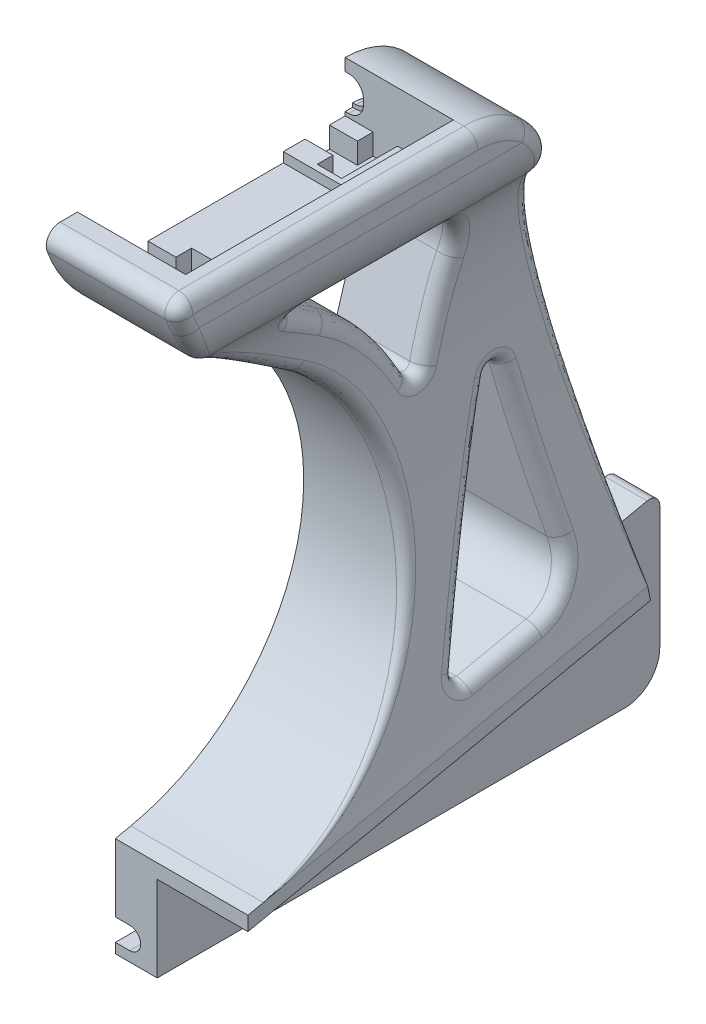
SolidWorks part; units mm, degrees
ref_plane "Front Plane" through (0, 0, 0) normal (0, 0, 1) x (1, 0, 0)
ref_plane "Top Plane" through (0, 0, 0) normal (0, 1, 0) x (1, 0, 0)
ref_plane "Right Plane" through (0, 0, 0) normal (1, 0, 0) x (0, 0, -1)
body saved out of another part "Stock-charging stand-1"
sketch "Sketch1" plane through (0, 0, 0) normal (-1, 0, 0) x (0, 0, 1)
  line L1 (73.1491, 82.0055) -> (57.4196, 70.9915) construction
  line L4 (71.0701, 0) -> (4.0701, 0) construction
  line L6 (26.2756, 85.1389) -> (12.7642, 21.573) construction
  line L7 (69.4336, 94.75) -> (38.1442, 94.75)
  line L8 (73.1491, 82.0055) -> (57.4196, 70.9915)
  line L9 (71.0701, 14.2914) -> (71.0701, 4.575) construction
  line L10 (12.7642, 21.573) -> (7.4455, 22.7035) construction
  line L11 (60.2722, 0) -> (9.02, 0)
  line L12 (-0.9299, 22.6314) -> (-0.9299, 5) construction
  line L13 (26.2756, 85.1389) -> (12.7642, 21.573)
  line L14 (8.8026, 22.4151) -> (12.7642, 21.573)
  line L15 (-1.9299, 14.6858) -> (-1.9299, 9.798)
  line L16 (79.0701, 13.2914) -> (79.0701, 1)
  line L17 (-0.9299, 5) -> (-0.9299, 22.6314) construction
  line L18 (12.7642, 21.573) -> (0.882, 24.0986) construction
  arc A0 (38.1442, 94.75) -> (26.2756, 85.1389) centre (38.1442, 82.6162) ccw construction
  arc A2 (73.1491, 82.0055) -> (80.8539, 92.0702) centre (61.104, 99.2077) ccw construction
  arc A3 (57.4196, 70.9915) -> (68.8598, 14.7612) centre (75.3645, 45.3636) ccw construction
  arc A6 (38.1442, 94.75) -> (26.2756, 85.1389) centre (38.1442, 82.6162) ccw
  arc A7 (80.8539, 92.0702) -> (78.9729, 94.75) centre (78.9729, 92.75) ccw construction
  arc A8 (73.1491, 82.0055) -> (75.4657, 83.8864) centre (61.104, 99.2077) ccw
  arc A9 (57.4196, 70.9915) -> (61.0389, 17.55) centre (75.3645, 45.3636) ccw
  arc A11 (69.4336, 94.75) -> (70.3875, 95.45) centre (69.4336, 95.75) ccw
  arc A12 (76.432, 84.1161) -> (70.3875, 95.45) centre (78.9729, 92.75) ccw
  arc A13 (61.252, -0.8) -> (79.0701, 1) centre (70.0701, 1) ccw
  arc A14 (79.0701, 13.2914) -> (62.3542, 17.9243) centre (70.0701, 13.2914) ccw
  arc A15 (8.0165, 23.5023) -> (-2.7299, 15.6656) centre (-0.9299, 24.4838) ccw
  arc A16 (-2.7299, 8.8182) -> (8.025, -0.9) centre (-0.9299, 0) ccw
  arc A17 (76.432, 84.1161) -> (75.4657, 83.8864) centre (76.1496, 83.1568) ccw
  arc A18 (61.0389, 17.55) -> (62.3542, 17.9243) centre (61.4968, 18.439) ccw
  arc A19 (60.2722, 0) -> (61.252, -0.8) centre (60.2722, -1) cw
  arc A20 (8.025, -0.9) -> (9.02, 0) centre (9.02, -1) cw
  arc A21 (-1.9299, 9.798) -> (-2.7299, 8.8182) centre (-2.9299, 9.798) cw
  arc A22 (-1.9299, 14.6858) -> (-2.7299, 15.6656) centre (-2.9299, 14.6858) ccw
  arc A23 (8.0165, 23.5023) -> (8.8026, 22.4151) centre (9.0105, 23.3932) ccw
  dimension "D1" = 18
  dimension "D8" = 1
  dimension "D2" = 1
  dimension "D3" = 1
  dimension "D4" = 1
  dimension "D6" = 1
extrude "Boss-Extrude1" [suppressed] add sketch "Sketch1" along normal blind 0.35 contours A15 A22 L15 A21 A16 A20 L11 A19 A13 L16 A14 A18 A9 L8 A8 A17 A12 A11 L7 A6 L13 L14 A23
sketch "Sketch3" [suppressed] plane through (0, 0, 0) normal (1, 0, 0) x (0, 0, -1)
  line L0 (-0.5701, 22.6314) -> (-0.5701, 31.6314) construction
  line L1 (-0.5701, 22.6314) -> (8.4299, 22.6314) construction
  line L2 (-0.5701, 22.6314) -> (5.7938, 28.9954) construction
  line L3 (-0.0701, 22.6314) -> (-0.0701, 31.6314)
  line L4 (-0.2166, 22.2779) -> (6.1474, 28.6418)
  line L5 (-0.5701, 22.1314) -> (8.4299, 22.1314)
  line L6 (-1.0701, 22.6314) -> (-1.0701, 31.6314)
  line L7 (-0.9237, 22.985) -> (5.4403, 29.3489)
  line L8 (-0.5701, 23.1314) -> (8.4299, 23.1314)
  line L9 (-0.0701, 22.6314) -> (-1.0701, 22.6314)
  line L10 (-0.0701, 31.6314) -> (-1.0701, 31.6314)
  line L11 (-0.2166, 22.2779) -> (-0.9237, 22.985)
  line L12 (6.1474, 28.6418) -> (5.4403, 29.3489)
  line L13 (-0.5701, 22.1314) -> (-0.5701, 23.1314)
  line L14 (8.4299, 22.1314) -> (8.4299, 23.1314)
  line L15 (-4.0701, 5) -> (-0.5346, 1.4645) construction
  line L16 (-2.3024, 3.2322) -> (4.0616, -3.1317) construction
  line L17 (-2.3024, 3.2322) -> (-2.3024, -5.7678) construction
  line L18 (-2.3024, 3.2322) -> (6.6976, 3.2322) construction
  line L19 (-2.3024, 2.7322) -> (6.6976, 2.7322)
  line L20 (-2.6559, 2.8787) -> (3.708, -3.4853)
  line L21 (-2.8024, 3.2322) -> (-2.8024, -5.7678)
  line L22 (-2.3024, 3.7322) -> (6.6976, 3.7322)
  line L23 (-1.9488, 3.5858) -> (4.4151, -2.7782)
  line L24 (-1.8024, 3.2322) -> (-1.8024, -5.7678)
  line L25 (-2.3024, 2.7322) -> (-2.3024, 3.7322)
  line L26 (6.6976, 2.7322) -> (6.6976, 3.7322)
  line L27 (-2.6559, 2.8787) -> (-1.9488, 3.5858)
  line L28 (3.708, -3.4853) -> (4.4151, -2.7782)
  line L29 (-2.8024, 3.2322) -> (-1.8024, 3.2322)
  line L30 (-2.8024, -5.7678) -> (-1.8024, -5.7678)
  line L31 (-70.5701, 0.5) -> (-70.5701, -6.5) construction
  line L32 (-70.5701, 0.5) -> (-77.5701, 0.5) construction
  line L33 (-70.5701, 0.5) -> (-75.5199, -4.4497) construction
  line L34 (-71.0701, 12.2467) -> (-71.0701, 0) construction
  line L36 (-71.0701, 0) -> (-60.2722, 0) construction
  line L37 (-71.0701, 0.5) -> (-71.0701, -6.5)
  line L38 (-70.9237, 0.8536) -> (-75.8734, -4.0962)
  line L39 (-70.5701, 1) -> (-77.5701, 1)
  line L40 (-70.0701, 0.5) -> (-70.0701, -6.5)
  line L41 (-70.2166, 0.1464) -> (-75.1663, -4.8033)
  line L42 (-70.5701, 0) -> (-77.5701, 0)
  line L43 (-71.0701, 0.5) -> (-70.0701, 0.5)
  line L44 (-71.0701, -6.5) -> (-70.0701, -6.5)
  line L45 (-70.9237, 0.8536) -> (-70.2166, 0.1464)
  line L46 (-75.8734, -4.0962) -> (-75.1663, -4.8033)
  line L47 (-70.5701, 1) -> (-70.5701, 0)
  line L48 (-77.5701, 1) -> (-77.5701, 0)
  line L49 (-70.5701, 13.7914) -> (-70.5701, 20.7914) construction
  line L50 (-71.0701, 14.2914) -> (-71.0701, 12.2467) construction
  line L52 (-70.5701, 13.7914) -> (-77.5701, 13.7914) construction
  line L53 (-70.5701, 13.7914) -> (-75.5199, 18.7412) construction
  line L54 (-70.0701, 13.7914) -> (-70.0701, 20.7914)
  line L55 (-70.2166, 14.145) -> (-75.1663, 19.0947)
  line L56 (-70.5701, 14.2914) -> (-77.5701, 14.2914)
  line L57 (-71.0701, 13.7914) -> (-71.0701, 20.7914)
  line L58 (-70.9237, 13.4379) -> (-75.8734, 18.3876)
  line L59 (-70.5701, 13.2914) -> (-77.5701, 13.2914)
  line L60 (-70.0701, 13.7914) -> (-71.0701, 13.7914)
  line L61 (-70.0701, 20.7914) -> (-71.0701, 20.7914)
  line L62 (-70.2166, 14.145) -> (-70.9237, 13.4379)
  line L63 (-75.1663, 19.0947) -> (-75.8734, 18.3876)
  line L64 (-70.5701, 14.2914) -> (-70.5701, 13.2914)
  line L65 (-77.5701, 14.2914) -> (-77.5701, 13.2914)
  line L66 (-78.9729, 92.75) -> (-78.9729, 100.75) construction
  line L67 (-78.9729, 92.75) -> (-85.277, 97.6753) construction
  line L68 (-78.9729, 92.75) -> (-86.4967, 90.031) construction
  line L69 (-80.8539, 92.0702) -> (-78.9729, 92.75) construction
  line L70 (-78.4729, 92.75) -> (-78.4729, 100.75)
  line L71 (-78.6651, 93.144) -> (-84.9692, 98.0693)
  line L72 (-79.1429, 93.2202) -> (-86.6666, 90.5012)
  line L73 (-79.4729, 92.75) -> (-79.4729, 100.75)
  line L74 (-79.2808, 92.356) -> (-85.5849, 97.2813)
  line L75 (-78.803, 92.2798) -> (-86.3268, 89.5607)
  line L76 (-78.4729, 92.75) -> (-79.4729, 92.75)
  line L77 (-78.4729, 100.75) -> (-79.4729, 100.75)
  line L78 (-78.6651, 93.144) -> (-79.2808, 92.356)
  line L79 (-84.9692, 98.0693) -> (-85.5849, 97.2813)
  line L80 (-79.1429, 93.2202) -> (-78.803, 92.2798)
  line L81 (-86.6666, 90.5012) -> (-86.3268, 89.5607)
  arc A0 (-4.0701, 0) -> (0.9299, 5) centre (-4.0701, 5) ccw construction
  dimension "D1" = 45
  dimension "D2" = 9
  dimension "D7" = 0.5
  dimension "D8" = 0.5
  dimension "D9" = 45
  dimension "D10" = 7
  dimension "D13" = 0.5
  dimension "D14" = 0.5
  dimension "D15" = 45
  dimension "D18" = 52
  dimension "D19" = 8
  dimension "D3" = 0.5
  dimension "D4" = 0.5
  dimension "D5" = 0.5
  dimension "D6" = 0.5
  dimension "D11" = 0.5
  dimension "D12" = 0.5
  dimension "D16" = 0.5
  dimension "D17" = 0.5
  dimension "D20" = 0.5
  dimension "D21" = 0.5
extrude "Boss-Extrude2" [suppressed] add sketch "Sketch3" along normal blind 3 contours L72 L81 L75 L80 L78 L74 | L71 L79 L74 L72 L73 | L71 L78 L76 L70 L77 L73 | L56 L65 L59 L64 L62 L58 | L55 L63 L58 L56 L57 | L55 L62 L60 L54 L61 L57 | L62 L60 L57 L56 L58 | L56 L64 L62 L55 L57 | L64 L56 L57 L60 | L25 L27 L23 L19 L26 L22 | L37 L44 L40 L43 | L41 L46 L38 L45 | L42 L48 L39 L47 | L21 L30 L24 L29 | L5 L14 L8 L13 | L4 L12 L7 L11 | L3 L10 L6 L9
chamfer "Chamfer1" [suppressed] distance 3 angle 45
